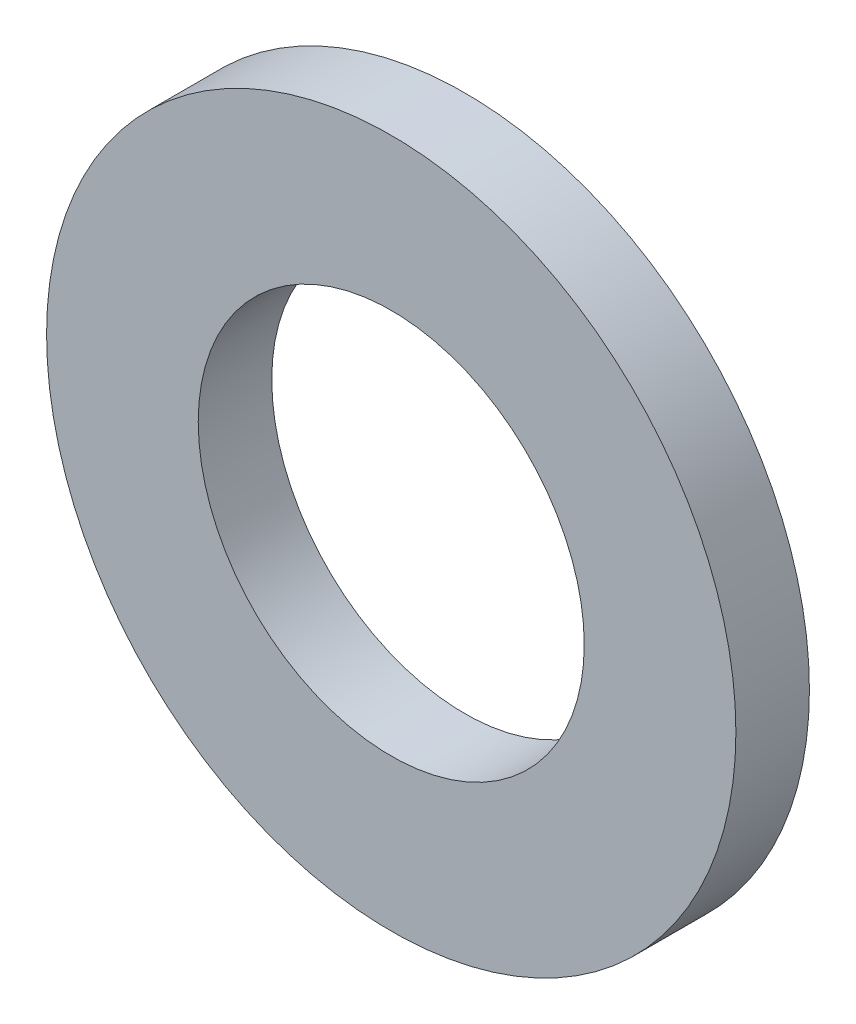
SolidWorks part; units mm, degrees
ref_plane "前视基准面" through (0, 0, 0) normal (0, 0, 1) x (1, 0, 0)
ref_plane "上视基准面" through (0, 0, 0) normal (0, 1, 0) x (1, 0, 0)
ref_plane "右视基准面" through (0, 0, 0) normal (1, 0, 0) x (0, 0, -1)
sketch "草图1" plane through (0, 0, 0) normal (0, 0, 1) x (1, 0, 0)
  circle A0 centre (0, 0) radius 7.5
  circle A1 centre (0, 0) radius 4.2
  dimension "d2" = 15
  dimension "d1" = 8.4
extrude "拉伸1" add sketch "草图1" along normal blind 1.6
